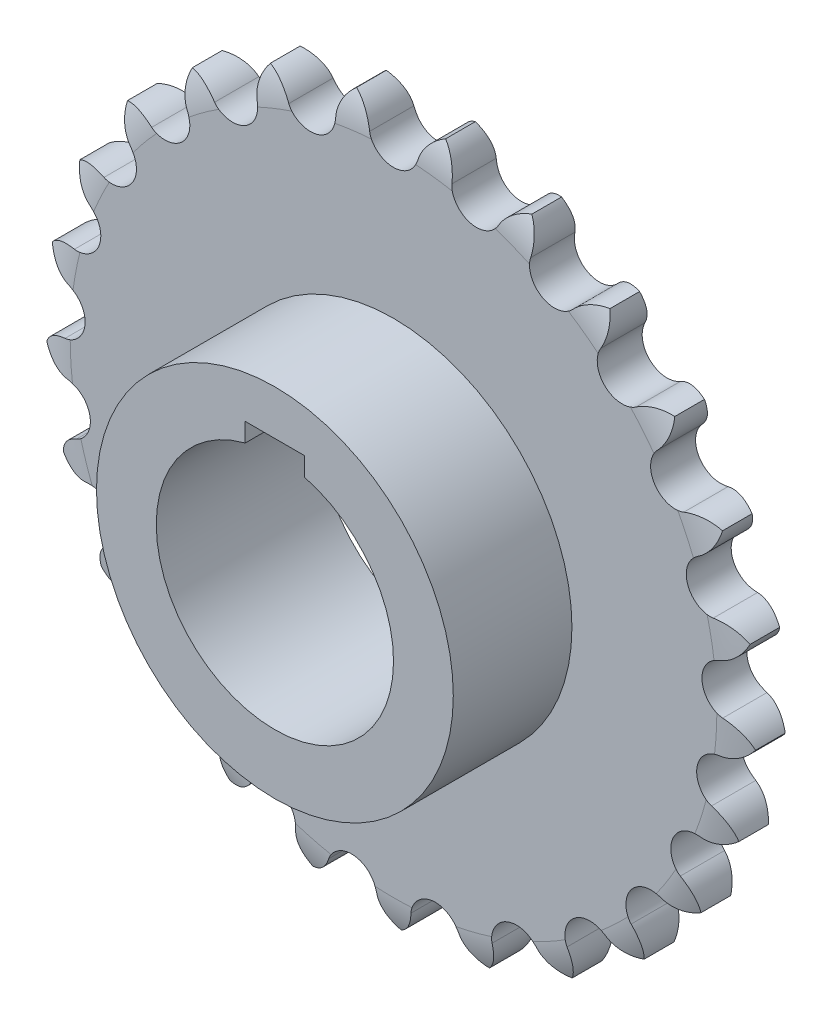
SolidWorks part; units mm, degrees
ref_plane "Alzado" through (0, 0, 0) normal (0, 0, 1) x (1, 0, 0)
ref_plane "Planta" through (0, 0, 0) normal (0, 1, 0) x (1, 0, 0)
ref_plane "Vista lateral" through (0, 0, 0) normal (1, 0, 0) x (0, 0, -1)
sketch "Croquis1" plane through (0, 0, 0) normal (0, 0, 1) x (1, 0, 0)
  line L0 (0, 0) -> (0, 53.5) construction
  line L1 (0, 57) -> (0, 57.5) construction
  circle A0 centre (0, 0) radius 57 construction
  circle A1 centre (0, 0) radius 53.5 construction
  circle A2 centre (0, 0) radius 52 construction
  arc A3 (-3.8808, 52.5307) -> (3.8808, 52.5307) centre (0, 53.5) ccw
  arc A4 (7.3536, 56.5237) -> (3.8808, 52.5307) centre (9.537, 51.118) ccw
  arc A5 (-7.3536, 56.5237) -> (-3.8808, 52.5307) centre (-9.537, 51.118) cw
  arc A6 (9.305, 51.8455) -> (16.8227, 49.9152) centre (13.3049, 51.8192) ccw
  arc A7 (6.9343, 56.5766) -> (9.305, 51.8455) centre (3.4751, 51.8838) cw
  arc A8 (21.1795, 52.9191) -> (16.8227, 49.9152) centre (21.9499, 47.1402) ccw
  arc A9 (21.9061, 47.9026) -> (28.7076, 44.1634) centre (25.7738, 46.8824) ccw
  arc A10 (20.7865, 53.0747) -> (21.9061, 47.9026) centre (16.2689, 49.3895) cw
  arc A11 (33.6745, 45.9894) -> (28.7076, 44.1634) centre (32.9836, 40.2005) ccw
  arc A12 (33.1308, 40.9498) -> (38.7887, 35.6367) centre (36.6233, 38.9998) ccw
  arc A13 (33.3325, 46.2379) -> (33.1308, 40.9498) centre (28.0405, 43.7919) cw
  arc A14 (44.0537, 36.1701) -> (38.7887, 35.6367) centre (41.9448, 30.7348) ccw
  arc A15 (42.2737, 31.424) -> (46.4326, 24.8707) centre (45.1715, 28.6667) ccw
  arc A16 (43.7842, 36.4958) -> (42.2737, 31.424) centre (38.0501, 35.4427) cw
  arc A17 (51.6648, 24.078) -> (46.4326, 24.8707) centre (48.2705, 19.338) ccw
  arc A18 (48.7604, 19.9237) -> (51.1589, 12.542) centre (50.8815, 16.5324) ccw
  arc A19 (51.4848, 24.4605) -> (48.7604, 19.9237) centre (45.669, 24.8666) cw
  arc A20 (56.0296, 10.4731) -> (51.1589, 12.542) centre (51.5632, 6.7261) ccw
  arc A21 (52.1834, 7.1716) -> (52.6707, -0.5747) centre (53.3944, 3.3593) ccw
  arc A22 (55.9504, 10.8883) -> (52.1834, 7.1716) centre (50.4183, 12.7279) cw
  arc A23 (56.8739, -3.79) -> (52.6707, -0.5747) centre (51.6159, -6.3085) ccw
  arc A24 (52.3274, -6.0312) -> (50.8731, -13.6553) centre (52.5524, -10.0249) ccw
  arc A25 (56.9004, -3.3681) -> (52.3274, -6.0312) centre (51.9996, -0.2105) cw
  arc A26 (54.1445, -17.8148) -> (50.8731, -13.6553) centre (48.4255, -18.9466) ccw
  arc A27 (49.1836, -18.855) -> (45.8788, -25.8779) centre (48.4082, -22.7792) ccw
  arc A28 (54.2752, -17.4128) -> (49.1836, -18.855) centre (50.3136, -13.1356) cw
  arc A29 (48.0131, -30.7204) -> (45.8788, -25.8779) centre (42.1922, -30.3943) ccw
  arc A30 (42.9493, -30.4941) -> (38.0019, -36.4745) centre (41.2225, -34.1022) ccw
  arc A31 (48.2396, -30.3635) -> (42.9493, -30.4941) centre (45.4662, -25.2354) cw
  arc A32 (38.8649, -41.6956) -> (38.0019, -36.4745) centre (33.3079, -39.9322) ccw
  arc A33 (34.0164, -40.2172) -> (27.7372, -44.7793) centre (31.4465, -43.2824) ccw
  arc A34 (39.173, -41.4063) -> (34.0164, -40.2172) centre (37.762, -35.7496) cw
  arc A35 (27.2746, -50.051) -> (27.7372, -44.7793) centre (22.3308, -46.961) ccw
  arc A36 (22.9461, -47.4132) -> (15.7296, -50.2704) centre (19.6947, -49.743) ccw
  arc A37 (27.645, -49.8473) -> (22.9461, -47.4132) centre (27.6851, -44.0175) cw
  arc A38 (13.9705, -55.2614) -> (15.7296, -50.2704) centre (9.9505, -51.0391) ccw
  arc A39 (10.434, -51.6301) -> (2.7337, -52.6029) centre (6.7053, -53.0781) ccw
  arc A40 (14.3799, -55.1563) -> (10.434, -51.6301) centre (15.8686, -49.5196) cw
  arc A41 (-0.2113, -56.9996) -> (2.7337, -52.6029) centre (-3.055, -51.9102) ccw
  arc A42 (-2.7337, -52.6029) -> (-10.434, -51.6301) centre (-6.7053, -53.0781) ccw
  arc A43 (0.2113, -56.9996) -> (-2.7337, -52.6029) centre (3.055, -51.9102) cw
  arc A44 (-14.3799, -55.1563) -> (-10.434, -51.6301) centre (-15.8686, -49.5196) ccw
  arc A45 (-15.7296, -50.2704) -> (-22.9461, -47.4132) centre (-19.6947, -49.743) ccw
  arc A46 (-13.9705, -55.2614) -> (-15.7296, -50.2704) centre (-9.9505, -51.0391) cw
  arc A47 (-27.645, -49.8473) -> (-22.9461, -47.4132) centre (-27.6851, -44.0175) ccw
  arc A48 (-27.7372, -44.7793) -> (-34.0164, -40.2172) centre (-31.4465, -43.2824) ccw
  arc A49 (-27.2746, -50.051) -> (-27.7372, -44.7793) centre (-22.3308, -46.961) cw
  arc A50 (-39.173, -41.4063) -> (-34.0164, -40.2172) centre (-37.762, -35.7496) ccw
  arc A51 (-38.0019, -36.4745) -> (-42.9493, -30.4941) centre (-41.2225, -34.1022) ccw
  arc A52 (-38.8649, -41.6956) -> (-38.0019, -36.4745) centre (-33.3079, -39.9322) cw
  arc A53 (-48.2396, -30.3635) -> (-42.9493, -30.4941) centre (-45.4662, -25.2354) ccw
  arc A54 (-45.8788, -25.8779) -> (-49.1836, -18.855) centre (-48.4082, -22.7792) ccw
  arc A55 (-48.0131, -30.7204) -> (-45.8788, -25.8779) centre (-42.1922, -30.3943) cw
  arc A56 (-54.2752, -17.4128) -> (-49.1836, -18.855) centre (-50.3136, -13.1356) ccw
  arc A57 (-50.8731, -13.6553) -> (-52.3274, -6.0312) centre (-52.5524, -10.0249) ccw
  arc A58 (-54.1445, -17.8148) -> (-50.8731, -13.6553) centre (-48.4255, -18.9466) cw
  arc A59 (-56.9004, -3.3681) -> (-52.3274, -6.0312) centre (-51.9996, -0.2105) ccw
  arc A60 (-52.6707, -0.5747) -> (-52.1834, 7.1716) centre (-53.3944, 3.3593) ccw
  arc A61 (-56.8739, -3.79) -> (-52.6707, -0.5747) centre (-51.6159, -6.3085) cw
  arc A62 (-55.9504, 10.8883) -> (-52.1834, 7.1716) centre (-50.4183, 12.7279) ccw
  arc A63 (-51.1589, 12.542) -> (-48.7604, 19.9237) centre (-50.8815, 16.5324) ccw
  arc A64 (-56.0296, 10.4731) -> (-51.1589, 12.542) centre (-51.5632, 6.7261) cw
  arc A65 (-51.4848, 24.4605) -> (-48.7604, 19.9237) centre (-45.669, 24.8666) ccw
  arc A66 (-46.4326, 24.8707) -> (-42.2737, 31.424) centre (-45.1715, 28.6667) ccw
  arc A67 (-51.6648, 24.078) -> (-46.4326, 24.8707) centre (-48.2705, 19.338) cw
  arc A68 (-43.7842, 36.4958) -> (-42.2737, 31.424) centre (-38.0501, 35.4427) ccw
  arc A69 (-38.7887, 35.6367) -> (-33.1308, 40.9498) centre (-36.6233, 38.9998) ccw
  arc A70 (-44.0537, 36.1701) -> (-38.7887, 35.6367) centre (-41.9448, 30.7348) cw
  arc A71 (-33.3325, 46.2379) -> (-33.1308, 40.9498) centre (-28.0405, 43.7919) ccw
  arc A72 (-28.7076, 44.1634) -> (-21.9061, 47.9026) centre (-25.7738, 46.8824) ccw
  arc A73 (-33.6745, 45.9894) -> (-28.7076, 44.1634) centre (-32.9836, 40.2005) cw
  arc A74 (-20.7865, 53.0747) -> (-21.9061, 47.9026) centre (-16.2689, 49.3895) ccw
  arc A75 (-16.8227, 49.9152) -> (-9.305, 51.8455) centre (-13.3049, 51.8192) ccw
  arc A76 (-21.1795, 52.9191) -> (-16.8227, 49.9152) centre (-21.9499, 47.1402) cw
  arc A77 (-6.9343, 56.5766) -> (-9.305, 51.8455) centre (-3.4751, 51.8838) ccw
  circle A78 centre (0, 0) radius 19
  point P186 (0, 0)
  dimension "D1" = 114
  dimension "D2" = 107
  dimension "D3" = 104
  dimension "D4" = 8
  dimension "D5" = 11.66
  dimension "D7" = 38
  dimension "D6" = 25
extrude "Saliente-Extruir1" add sketch "Croquis1" along normal mid plane 7.2 contours A5 A77 A75 A76 A74 A72 A73 A71 A69 A70 A68 A66 A67 A65 A63 A64 A62 A60 A61 A59 A57 A58 A56 A54 A55 A53 A51 A52 A50 A48 A49 A47 A45 A46 A44 A42 A43 A41 A39 A40 A38 A36 A37 A35 A33 A34 A32 A30 A31 A29 A27
sketch "Croquis2" plane through (0, 0, 3.6) normal (0, 0, 1) x (1, 0, 0)
  circle A0 centre (0, 0) radius 28.575
  circle A1 centre (0, 0) radius 19 construction
  circle A2 centre (0, 0) radius 19
  dimension "D1" = 57.15
extrude "Saliente-Extruir2" add sketch "Croquis2" along normal blind 19
sketch "Croquis3" plane through (0, 0, 22.6) normal (0, 0, 1) x (1, 0, 0)
  line L0 (0, 0) -> (0, 19) construction
  line L2 (-4.75, 16.6) -> (4.75, 16.6)
  line L3 (-4.75, 16.6) -> (-4.75, 21.4)
  line L4 (-4.75, 21.4) -> (4.75, 21.4)
  line L5 (4.75, 16.6) -> (4.75, 21.4)
  line L6 (-4.75, 16.6) -> (4.75, 21.4) construction
  line L7 (-4.75, 21.4) -> (4.75, 16.6) construction
  circle A0 centre (0, 0) radius 19 construction
  dimension "D1" = 9.5
  dimension "D2" = 4.8
extrude "Cortar-Extruir1" cut sketch "Croquis3" against normal through all
sketch "Croquis4" plane through (0, 0, 0) normal (1, 0, 0) x (0, 0, -1)
  line L0 (0, 56.4271) -> (0, 46.1363) construction
  line L1 (-3.6, 56.4271) -> (3.6, 56.4271) construction
  line L2 (-2.1, 59.4623) -> (-2.1, 48.7061) construction
  line L3 (-3.6, 56.4271) -> (-3.6, 51.8455) construction
  line L4 (-2.1, 57.4271) -> (-6.1881, 57.4271)
  line L5 (-6.1881, 57.4271) -> (-6.1881, 51.0771)
  line L6 (-6.1881, 51.0771) -> (-3.6, 51.0771)
  line L7 (-3.6, 52.8816) -> (-3.6, 47.9026) construction
  line L8 (6.1881, 51.0771) -> (3.6, 51.0771)
  line L9 (6.1881, 57.4271) -> (6.1881, 51.0771)
  line L10 (2.1, 57.4271) -> (6.1881, 57.4271)
  arc A0 (-2.1, 57.4271) -> (-3.6, 51.0771) centre (9.0951, 51.4305) ccw
  arc A1 (2.1, 57.4271) -> (3.6, 51.0771) centre (-9.0951, 51.4305) cw
  dimension "D3" = 12.7
  dimension "D1" = 1.5
  dimension "D2" = 1
  dimension "D4" = 6.35
ref_axis "Eje1" through (0, 0, 22.6) along (0, 0, -1)
revolve "Cortar-Revolución1" cut sketch "Croquis4" angle 360 about axis through (0, 0, 22.6) along (0, 0, -1)
